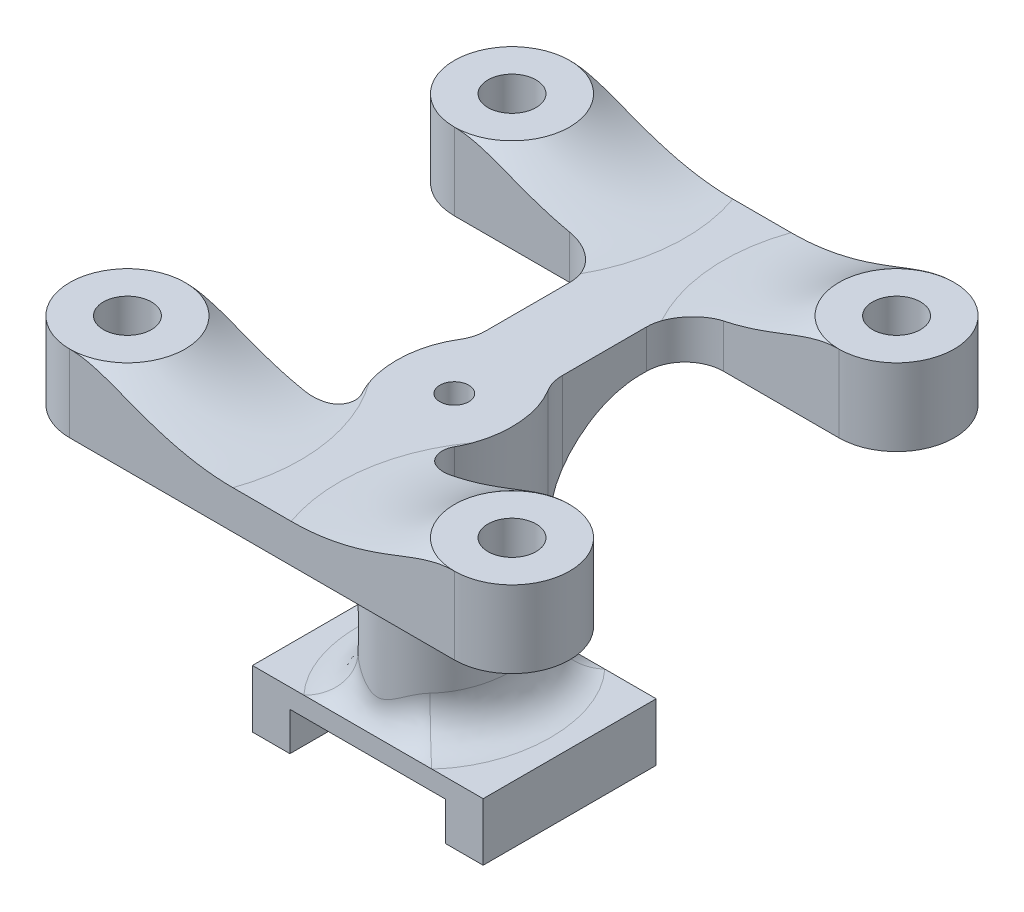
SolidWorks part; units mm, degrees
ref_plane "Front Plane" through (0, 0, 0) normal (0, 0, 1) x (1, 0, 0)
ref_plane "Top Plane" through (0, 0, 0) normal (0, 1, 0) x (1, 0, 0)
ref_plane "Right Plane" through (0, 0, 0) normal (1, 0, 0) x (0, 0, -1)
sketch "Sketch1" plane through (0, 0, 0) normal (0, 1, 0) x (1, 0, 0)
  line L0 (-12.8161, 0) -> (16.9404, 0) construction
  circle A0 centre (0, 0) radius 0.75
  ellipse E0 centre (0, 0) end of major axis (0, 4) minor radius 3
  dimension "D3" = 1.5
  dimension "D1" = 6
  dimension "D2" = 8
extrude "Boss-Extrude1" add sketch "Sketch1" along normal blind 14
sketch "Sketch3" plane through (0, 0, 0) normal (0, 1, 0) x (1, 0, 0)
  line L1 (-6, 4.5) -> (6, 4.5) construction
  line L3 (-6, -4.5) -> (6, -4.5) construction
  line L5 (-6, 4.5) -> (6, -4.5) construction
  line L6 (-6, -4.5) -> (6, 4.5) construction
  line L10 (-6, -4.5) -> (-6, 4.5) construction
  line L11 (6, -4.5) -> (6, 4.5) construction
  line L13 (-6, -4.5) -> (6, -4.5)
  line L14 (-6, -4.5) -> (-6, 4.5)
  line L15 (-6, 4.5) -> (6, 4.5)
  line L16 (6, -4.5) -> (6, 4.5)
  ellipse E1 centre (0, 0) end of major axis (0, 4) minor radius 3 construction
  ellipse E2 centre (0, 0) end of major axis (0, 4) minor radius 3
  point P0 (0, 0)
  dimension "D1" = 12
  dimension "D2" = 9
extrude "Boss-Extrude2" add sketch "Sketch3" along normal blind 1
sketch "Sketch4" plane through (0, 0, 0) normal (0, -1, 0) x (1, 0, 0)
  line L2 (6, -4.5) -> (-6, -4.5) construction
  line L5 (0, 6.8846) -> (0, -6.9454) construction
  line L18 (-6, 4.5) -> (-4.05, 4.5)
  line L19 (-6, 4.5) -> (-6, -4.5)
  line L20 (-6, -4.5) -> (-4.05, -4.5)
  line L21 (-4.05, 4.5) -> (-4.05, -4.5)
  line L23 (6, 4.5) -> (4.05, 4.5)
  line L24 (6, 4.5) -> (6, -4.5)
  line L25 (6, -4.5) -> (4.05, -4.5)
  line L26 (4.05, 4.5) -> (4.05, -4.5)
  dimension "D1" = 8.1
extrude "Boss-Extrude3" add sketch "Sketch4" along normal blind 2
sketch "Sketch5" plane through (0, 14, 0) normal (0, 1, 0) x (1, 0, 0)
  line L0 (0, 16.1297) -> (0, -17.1122) construction
  line L1 (-10, 13) -> (10, 13) construction
  line L6 (-10, 13) -> (10, 13) construction
  line L7 (-10, 13) -> (-10, -7) construction
  line L8 (-10, -7) -> (10, -7) construction
  line L9 (10, 13) -> (10, -7) construction
  line L10 (-10, 13) -> (10, -7) construction
  line L19 (-10, -7) -> (10, 13) construction
  line L20 (-10, 16) -> (10, 16)
  line L21 (-10, 10) -> (10, 10) construction
  line L22 (-10, -7) -> (10, -7) construction
  line L23 (-10, -4) -> (10, -4) construction
  line L24 (-10, -10) -> (10, -10)
  line L25 (-2, 10) -> (-2, 2.9814)
  line L26 (2, 10) -> (2, 2.9814)
  line L27 (-10, 10) -> (-2, 10)
  line L28 (2, 10) -> (10, 10)
  line L29 (-10, -4) -> (-2, -4)
  line L30 (2, -4) -> (10, -4)
  line L31 (-2, -2.9814) -> (-2, -4)
  line L32 (2, -4) -> (2, -2.9814)
  arc A9 (-10, 16) -> (-10, 10) centre (-10, 13) ccw
  arc A10 (10, 10) -> (10, 16) centre (10, 13) ccw
  arc A11 (-10, -4) -> (-10, -10) centre (-10, -7) ccw
  arc A12 (10, -10) -> (10, -4) centre (10, -7) ccw
  circle A13 centre (-10, 13) radius 1.25
  circle A14 centre (10, 13) radius 1.25
  circle A15 centre (10, -7) radius 1.25
  circle A16 centre (-10, -7) radius 1.25
  ellipse E1 centre (0, 0) end of major axis (0, 4) minor radius 3 construction
  ellipse E3 centre (0, 0) end of major axis (0, 4) minor radius 3 (-2, -2.9814) -> (2, -2.9814) ccw
  ellipse E4 centre (0, 0) end of major axis (0, 4) minor radius 3 (2, 2.9814) -> (-2, 2.9814) ccw
  point P3 (0, 3)
  point P8 (0, 13)
  point P13 (0, -7)
  dimension "D3" = 2.5
  dimension "D4" = 4
  dimension "D2" = 3
  dimension "D1" = 20
  dimension "D5" = 3
extrude "Boss-Extrude4" add sketch "Sketch5" against normal blind 2 contours L28 A10 L20 A9 L27 L25 L26 A14 A13 M20 | L24 A12 L30 L32 L31 L29 A11 A16 A15 M20
fillet "Fillet4" radius 4 2 edges at (0, 12, -4) (0, 12, 4)
sketch "Sketch6" plane through (0, 14, 0) normal (0, 1, 0) x (1, 0, 0)
  circle A0 centre (-10, -7) radius 3
  circle A1 centre (10, -7) radius 1.25
  circle A2 centre (10, -7) radius 3
  circle A3 centre (-10, -7) radius 1.25
  circle A4 centre (-10, 13) radius 3
  circle A5 centre (-10, 13) radius 1.25
  circle A6 centre (10, 13) radius 3
  circle A7 centre (10, 13) radius 1.25
  circle A8 centre (10, 13) radius 1.25 construction
  arc A9 (10, 10) -> (10, 16) centre (10, 13) ccw construction
  arc A10 (-10, 16) -> (-10, 10) centre (-10, 13) ccw construction
  circle A11 centre (-10, 13) radius 1.25 construction
  circle A12 centre (10, -7) radius 1.25 construction
  arc A13 (10, -10) -> (10, -4) centre (10, -7) ccw construction
  circle A14 centre (-10, -7) radius 1.25 construction
  arc A15 (-10, -4) -> (-10, -10) centre (-10, -7) ccw construction
extrude "Boss-Extrude5" add sketch "Sketch6" along normal blind 2
fillet "Fillet7" radius 2 6 edges at (-2, 13, -10) (2, 13, -10) (-2, 12.1521, 4) (2, 12.1521, 4) (2, 11, -2.9814) (-2, 11, -2.9814)
fillet "Fillet8" radius 1 2 edges at (2, 11, 2.9814) (-2, 11, 2.9814)
fillet "Fillet9" radius 2 1 edges at (0, 1, -4)
fillet "Fillet10" radius 10 4 edges at (7, 14, -13) (-7, 14, -13) (7, 14, 7) (-7, 14, 7)
